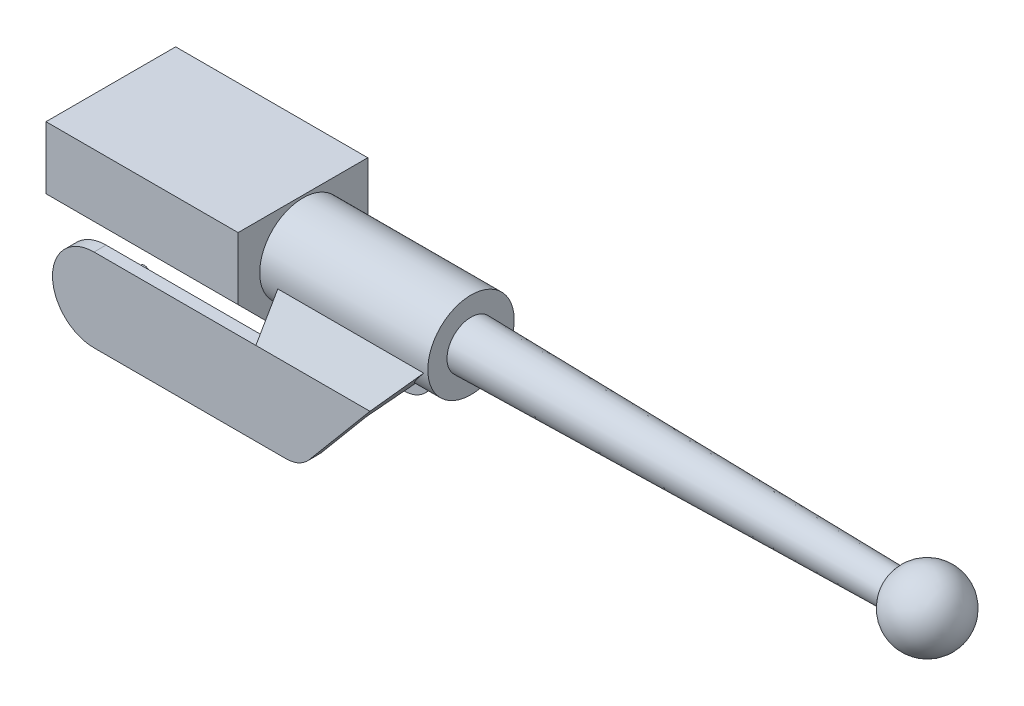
SolidWorks part; units mm, degrees
ref_plane "Front" through (0, 0, 0) normal (0, 0, 1) x (1, 0, 0)
ref_plane "Top" through (0, 0, 0) normal (0, 1, 0) x (1, 0, 0)
ref_plane "Right" through (0, 0, 0) normal (1, 0, 0) x (0, 0, -1)
imported_body "Imported"
other "Move Face1"
